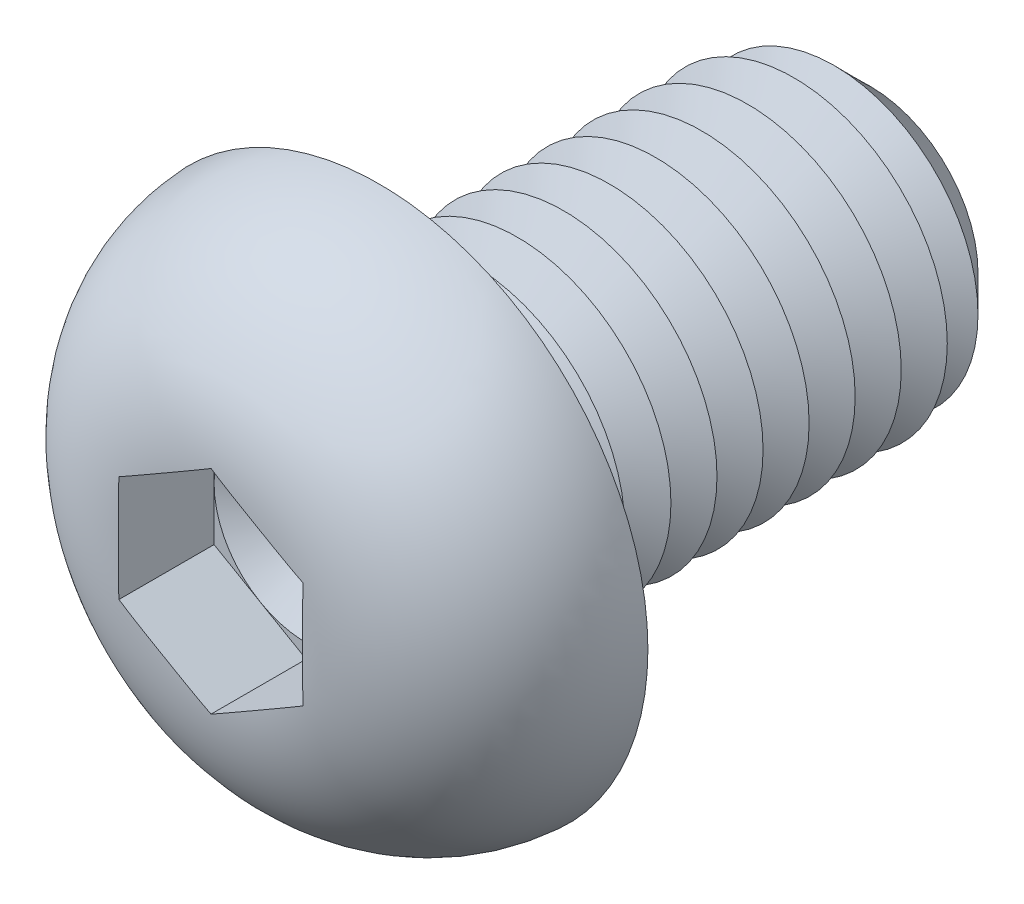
SolidWorks part; units mm, degrees
ref_plane "Front Plane" through (0, 0, 0) normal (0, 0, 1) x (1, 0, 0)
ref_plane "Top Plane" through (0, 0, 0) normal (0, 1, 0) x (1, 0, 0)
ref_plane "Right Plane" through (0, 0, 0) normal (1, 0, 0) x (0, 0, -1)
sketch "Sketch1" plane through (0, 0, 0) normal (1, 0, 0) x (0, 0, -1)
  line L0 (-47.9342, 0) -> (60.3146, 0) construction
sketch "Sketch2" plane through (0, 0, 0) normal (1, 0, 0) x (0, 0, -1)
  line L0 (0, 0) -> (-5.5, 0)
  line L1 (-47.9342, 0) -> (60.3146, 0) construction
  line L2 (-5.5, 0) -> (-5.5, 2.9578)
  line L3 (0, 8.75) -> (0, 0)
  arc A0 (-5.5, 2.9578) -> (0, 8.75) centre (0.3, 2.9578) cw
  dimension "D1" = 5.8
  dimension "D2" = 5.5
  dimension "D3" = 8.75
revolve "Revolve1" add sketch "Sketch2" angle 360 about L0
sketch "Sketch3" plane through (0, 0, 5.5) normal (0, 0, 1) x (1, 0, 0)
  line L1 (0, 3.4641) -> (-3, 1.7321)
  line L2 (-3, 1.7321) -> (-3, -1.7321)
  line L3 (-3, -1.7321) -> (0, -3.4641)
  line L4 (0, -3.4641) -> (3, -1.7321)
  line L5 (3, -1.7321) -> (3, 1.7321)
  line L6 (3, 1.7321) -> (0, 3.4641)
  circle A0 centre (0, 0) radius 3 construction
  dimension "D1" = 6
extrude "Cut-Extrude1" cut sketch "Sketch3" against normal blind 3.12
sketch "Sketch4" plane through (0, 0, 0) normal (0, 0, -1) x (-1, 0, 0)
  circle A0 centre (0, 0) radius 5
  dimension "D1" = 10
extrude "Boss-Extrude1" add sketch "Sketch4" along normal blind 16
chamfer "Chamfer1" distance 1.5 angle 45 1 edges at (-5, 0, -16)
sketch "Sketch5" plane through (0, 0, 0) normal (1, 0, 0) x (0, 0, -1)
  line L0 (1.5, 5) -> (3, 5)
  line L1 (14.5, 5) -> (0, 5) construction
  line L2 (3, 5) -> (2.25, 3.701)
  line L3 (2.25, 3.701) -> (1.5, 5)
  line L4 (0, -8.75) -> (0, 8.75) construction
  line L5 (14.5, 5) -> (0, 5) construction
  dimension "D1" = 1.5
  dimension "D2" = 1.5
revolve "Cut-Revolve1" cut sketch "Sketch5" angle 360 about L0
pattern_linear "LPattern1" count 9 spacing 1.5 along (0, 0, -1) of "Cut-Revolve1"
fillet "Fillet2" radius 0.6 1 edges at (5, 0, 0)
sketch "Sketch6" plane through (0, 0, 2.38) normal (0, 0, 1) x (1, 0, 0)
  line L0 (0, -3.4641) -> (3, -1.7321) construction
  circle A0 centre (0, 0) radius 3
extrude "Cut-Extrude2" cut sketch "Sketch6" against normal through all draft 60
